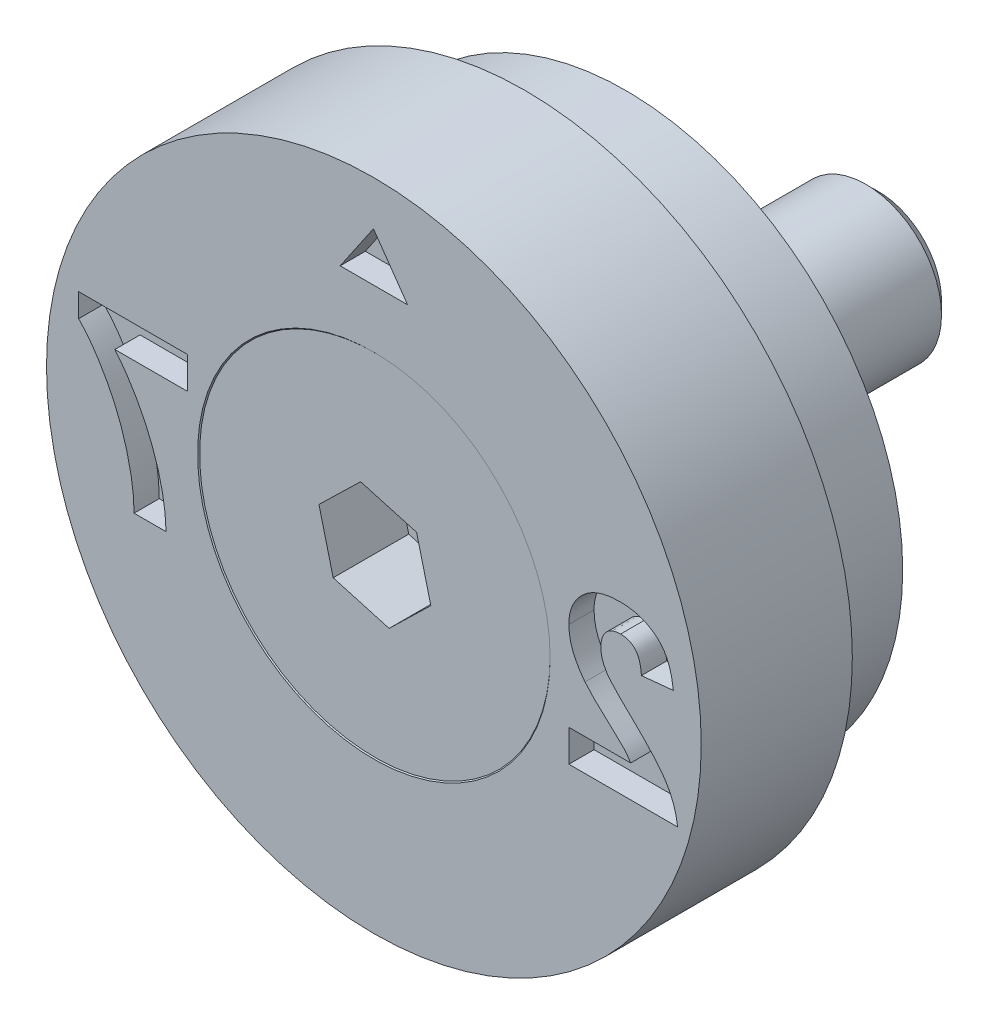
SolidWorks part; units mm, degrees
other "<M3 X .5 FHCS>-<Imported1>"
ref_plane "Front Plane" through (0, 0, 0) normal (0, 0, 1) x (1, 0, 0)
ref_plane "Top Plane" through (0, 0, 0) normal (0, 1, 0) x (1, 0, 0)
ref_plane "Right Plane" through (0, 0, 0) normal (1, 0, 0) x (0, 0, -1)
imported_body "Imported1"
sketch "Sketch1" plane through (0, 0, 0) normal (0, 0, 1) x (1, 0, 0)
  text T0 "2      7" font "Arial" height 3.302
  dimension "D1" = 1.651
  dimension "D2" = 6.2
extrude "Cut-Extrude1" cut sketch "Sketch1" against normal blind 0.5
inserted part "M3 X .5 FHCS"
move or copy body "Body-Move/Copy2" placed by mates yes
